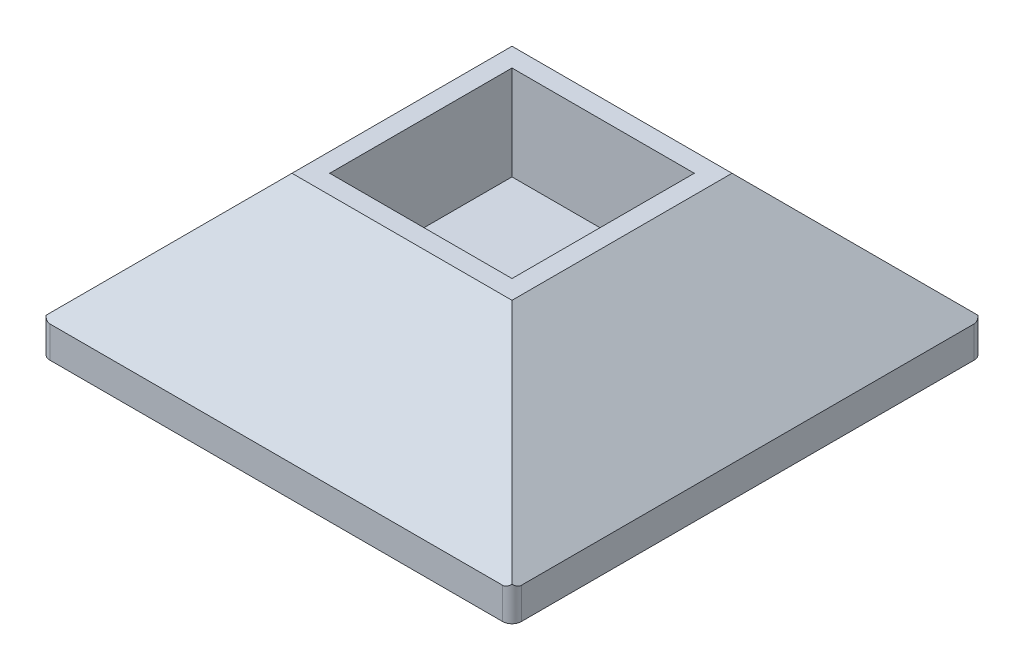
SolidWorks part; units mm, degrees
ref_plane "Front Plane" through (0, 0, 0) normal (0, 0, 1) x (1, 0, 0)
ref_plane "Top Plane" through (0, 0, 0) normal (0, 1, 0) x (1, 0, 0)
ref_plane "Right Plane" through (0, 0, 0) normal (1, 0, 0) x (0, 0, -1)
sketch "Sketch1" plane through (0, 0, 0) normal (0, 1, 0) x (1, 0, 0)
  line L1 (0, 0) -> (150, 0)
  line L2 (0, 0) -> (0, -150)
  line L3 (0, -150) -> (150, -150)
  line L4 (150, 0) -> (150, -150)
  dimension "D1" = 150
extrude "Boss-Extrude1" add sketch "Sketch1" along normal blind 50
sketch "Sketch2" plane through (0, 50, 0) normal (0, 1, 0) x (1, 0, 0)
  line L0 (150, -150) -> (150, 0) construction
  line L7 (150, 0) -> (0, 0) construction
  line L10 (75, 0) -> (75, -150) construction
  line L11 (0, -150) -> (150, -150) construction
  line L12 (0, -75) -> (150, -75) construction
  line L13 (0, 0) -> (0, -150) construction
  line L15 (46, -46) -> (104, -46)
  line L16 (46, -46) -> (46, -104)
  line L17 (46, -104) -> (104, -104)
  line L18 (104, -46) -> (104, -104)
  line L19 (46, -46) -> (104, -104) construction
  line L20 (46, -104) -> (104, -46) construction
  point P0 (75, -75)
  dimension "D1" = 58
extrude "Cut-Extrude1" cut sketch "Sketch2" against normal blind 30
chamfer "Chamfer1" distance 40 angle 45 4 edges at (75, 50, 0) (0, 50, 75) (150, 50, 75) (75, 50, 150)
fillet "Fillet1" radius 3 4 edges at (0, 5, 0) (150, 5, 0) (0, 5, 150) (150, 5, 150)
